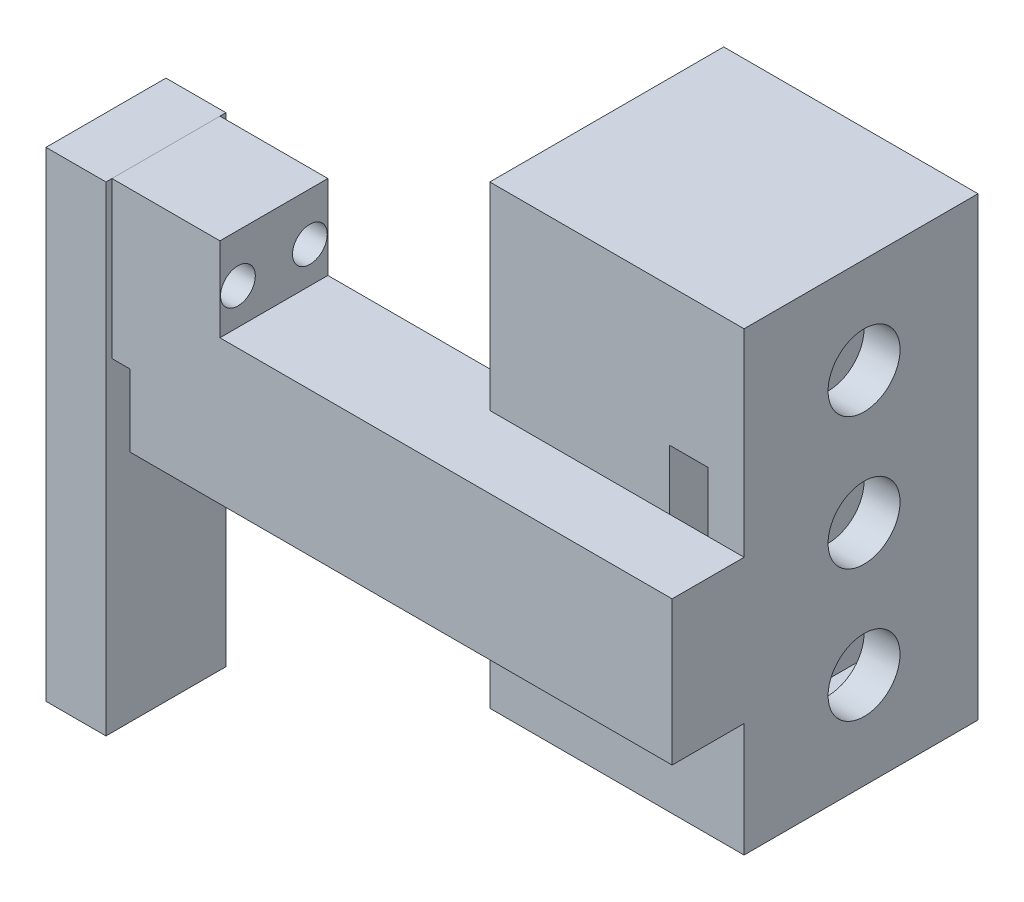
SolidWorks part; units mm, degrees
ref_plane "前视基准面" through (0, 0, 0) normal (0, 0, 1) x (1, 0, 0)
ref_plane "上视基准面" through (0, 0, 0) normal (0, 1, 0) x (1, 0, 0)
ref_plane "右视基准面" through (0, 0, 0) normal (1, 0, 0) x (0, 0, -1)
sketch "草图1" plane through (0, 0, 0) normal (1, 0, 0) x (0, 0, -1)
  line L0 (7, 38) -> (7, 0) construction
  line L1 (0, 0) -> (16.5, 0)
  line L2 (0, 0) -> (0, 38)
  line L3 (0, 38) -> (16.5, 38)
  line L4 (16.5, 0) -> (16.5, 38)
  line L5 (0, 19) -> (16.5, 19) construction
  circle A0 centre (7, 19) radius 3
  circle A1 centre (7, 30) radius 3
  circle A2 centre (7, 8) radius 3
  dimension "D4" = 6
  dimension "D7" = 6
  dimension "D1" = 38
  dimension "D2" = 16.5
  dimension "D3" = 7
  dimension "D5" = 8
  dimension "D6" = 22
extrude "凸台-拉伸1" add sketch "草图1" along normal blind 3
sketch "草图2" plane through (0, 0, 0) normal (1, 0, 0) x (0, 0, -1)
  line L0 (0, 19) -> (16.5, 19) construction
  line L1 (0, 0) -> (16.5, 0)
  line L2 (0, 0) -> (0, 38)
  line L3 (0, 38) -> (16.5, 38)
  line L4 (16.5, 0) -> (16.5, 38)
  circle A0 centre (7, 19) radius 4
  circle A1 centre (7, 30) radius 5
  circle A2 centre (7, 8) radius 5
  dimension "D1" = 10
  dimension "D2" = 8
extrude "凸台-拉伸2" add sketch "草图2" against normal blind 3 from offset 3.2 separate body
sketch "草图3" plane through (-3.2, 0, 0) normal (1, 0, 0) x (0, 0, -1)
  line L0 (16.5, 38) -> (0, 38) construction
  line L1 (0, 0) -> (16.5, 0)
  line L2 (0, 0) -> (0, 38)
  line L3 (0, 38) -> (16.5, 38)
  line L4 (16.5, 0) -> (16.5, 38)
  line L5 (16.5, 0) -> (16.5, 38) construction
  line L6 (0, 19) -> (16.5, 19) construction
  circle A0 centre (7, 19) radius 3
  circle A1 centre (7, 30) radius 5
  circle A2 centre (7, 8) radius 5
  dimension "D1" = 6
  dimension "D2" = 10
extrude "凸台-拉伸3" add sketch "草图3" along normal blind 3 from offset 15 separate body
sketch "草图7" plane through (0, 0, 0) normal (0, 0, 1) x (1, 0, 0)
  line L0 (-18.2, 38) -> (-18.2, 0) construction
  line L1 (3, 38) -> (-18.2, 38)
  line L2 (3, 38) -> (3, 35)
  line L3 (3, 35) -> (-18.2, 35)
  line L4 (-18.2, 38) -> (-18.2, 35)
  line L6 (3, 0) -> (-18.2, 0)
  line L7 (3, 0) -> (3, 3)
  line L8 (3, 3) -> (-18.2, 3)
  line L9 (-18.2, 0) -> (-18.2, 3)
  dimension "D1" = 3
  dimension "D2" = 3
extrude "凸台-拉伸4" add sketch "草图7" against normal through all
sketch "草图8" plane through (0, 0, 0) normal (0, 0, 1) x (1, 0, 0)
  line L0 (-43.7, 15.5) -> (-42.2, 15.5)
  line L1 (3, 19) -> (-47.7584, 19) construction
  line L2 (-18.2, 38) -> (3, 38)
  line L3 (-18.2, 38) -> (-18.2, 21.5)
  line L4 (-18.2, 0) -> (3, 0)
  line L5 (3, 38) -> (3, 0)
  line L6 (-43.7, 41.5101) -> (-43.7, 6.5548) construction
  line L7 (-43.7, 28.5) -> (-43.7, 15.5)
  line L8 (-42.2, 9.5) -> (-18.2, 9.5)
  line L9 (-43.7, 28.5) -> (-34.7, 28.5)
  line L10 (-34.7, 28.5) -> (-34.7, 21.5)
  line L11 (-34.7, 21.5) -> (-18.2, 21.5)
  line L12 (-18.2, 9.5) -> (-18.2, 0)
  line L13 (-42.2, 15.5) -> (-42.2, 9.5)
  point P12 (-26.45, 21.5)
  dimension "D1" = 21.2
  dimension "D2" = 25.5
  dimension "D3" = 9.5
  dimension "D4" = 2.5
  dimension "D5" = 9
  dimension "D6" = 7
  dimension "D7" = 13
  dimension "D8" = 1.5
extrude "凸台-拉伸5" add sketch "草图8" along normal blind 3
sketch "草图9" plane through (0, 0, 0) normal (0, 0, 1) x (1, 0, 0)
  line L0 (-34.7, 21.5) -> (-34.7, 28.5)
  line L1 (-34.7, 28.5) -> (-43.7, 28.5)
  line L2 (-43.7, 28.5) -> (-43.7, 15.5)
  line L3 (-42.2, 9.5) -> (3, 9.5)
  line L4 (3, 0) -> (3, 38) construction
  line L5 (-34.7, 21.5) -> (3, 21.5)
  line L6 (3, 21.5) -> (3, 9.5)
  line L7 (-43.7, 15.5) -> (-42.2, 15.5)
  line L8 (-42.2, 15.5) -> (-42.2, 9.5)
  line L9 (-42.2, 9.5) -> (-18.2, 9.5) construction
extrude "凸台-拉伸6" add sketch "草图9" along normal blind 9
sketch "草图10" plane through (0, 0, 0) normal (1, 0, 0) x (0, 0, -1)
  line L0 (0, 26.4875) -> (-3, 26.4875)
  line L1 (-3, 21.5) -> (-3, 38) construction
  line L2 (-3, 26.4875) -> (-3, 21.25)
  line L3 (-3, 21.25) -> (-6, 21.25)
  line L4 (0, 26.4875) -> (1.7981, 17.5313)
  line L5 (1.7981, 17.5313) -> (0, 11.5125)
  line L6 (0, 35) -> (0, 3) construction
  line L7 (0, 11.5125) -> (-3, 11.5125)
  line L8 (-3, 0) -> (-3, 9.5) construction
  line L9 (-3, 11.5125) -> (-3, 16.75)
  line L10 (-3, 16.75) -> (-6, 16.75)
  line L11 (-6, 16.75) -> (-6, 21.25)
  circle A0 centre (7, 19) radius 10.25 construction
  dimension "D1" = 20.5
  dimension "D2" = 3
extrude "切除-拉伸1" cut sketch "草图10" against normal up to surface (3.2 mm away)
sketch "草图11" plane through (0, 0, 0) normal (0, 0, 1) x (1, 0, 0)
  line L0 (-34.7, 28.5) -> (-43.7, 28.5) construction
  line L1 (-43.7, 28.5) -> (-48.7, 28.5)
  line L2 (-43.7, 28.5) -> (-43.7, -11.5)
  line L3 (-43.7, -11.5) -> (-48.7, -11.5)
  line L4 (-48.7, 28.5) -> (-48.7, -11.5)
  dimension "D1" = 40
  dimension "D2" = 5
extrude "凸台-拉伸7" add sketch "草图11" along normal blind 9.5 and the other way blind 0.5 separate body
sketch "草图12" plane through (-34.7, 0, 0) normal (1, 0, 0) x (0, 0, -1)
  line L0 (-9, 24.5) -> (0, 24.5) construction
  line L1 (-9, 21.5) -> (-9, 28.5) construction
  line L2 (0, 35) -> (0, 3) construction
  line L3 (-4.5, 24.5) -> (-4.5, 28.1455) construction
  line L4 (-9, 28.5) -> (0, 28.5) construction
  line L5 (16.5, 38) -> (-3, 38) construction
  circle A0 centre (-1.5, 24.5) radius 1.45
  circle A1 centre (-7.5, 24.5) radius 1.45
  dimension "D3" = 2.9
  dimension "D1" = 4
  dimension "D2" = 3
  dimension "D4" = 13.5
extrude "切除-拉伸4" cut sketch "草图12" against normal through all
